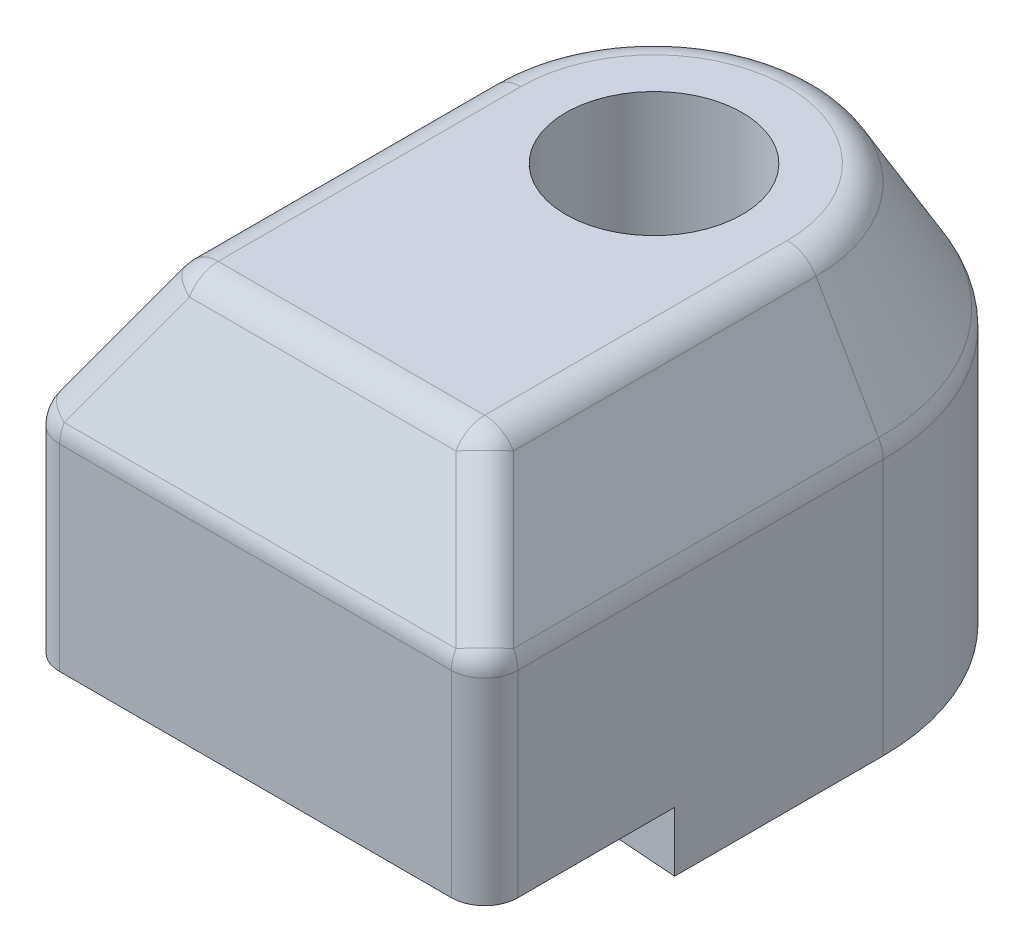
SolidWorks part; units mm, degrees
ref_plane "Front Plane" through (0, 0, 0) normal (0, 0, 1) x (1, 0, 0)
ref_plane "Top Plane" through (0, 0, 0) normal (0, 1, 0) x (1, 0, 0)
ref_plane "Right Plane" through (0, 0, 0) normal (1, 0, 0) x (0, 0, -1)
sketch "Sketch1" plane through (0, 0, 0) normal (0, 1, 0) x (1, 0, 0)
  line L0 (-8.763, 0) -> (-8.763, -15.24)
  line L1 (-8.763, -15.24) -> (8.763, -15.24)
  line L2 (8.763, -15.24) -> (8.763, 0)
  arc A0 (8.763, 0) -> (-8.763, 0) centre (0, 0) ccw
  arc A1 (8.89, 0) -> (-8.89, 0) centre (0, 0) ccw construction
  dimension "D1" = 0.127
  dimension "D2" = 15.24
extrude "Boss-Extrude1" add sketch "Sketch1" along normal blind 15.24
hole_wizard "H (0.266) Diameter Hole1" positions "Sketch2" profile "Sketch3" hole size "H" standard "ANSI Inch"
sketch "Sketch2" plane through (0, 15.24, 0) normal (0, 1, 0) x (1, 0, 0)
  point P0 (0, 0)
sketch "Sketch3" plane through (0, 15.24, 0) normal (1, 0, 0) x (0, 0, 1)
  line L0 (0, 0) -> (0, 15.24)
  line L1 (0, 15.24) -> (3.3782, 15.24)
  line L2 (3.3782, 15.24) -> (3.3782, 0)
  line L5 (3.3782, 0) -> (0, 0)
  line L11 (0, -6.35) -> (0, 107.95) construction
  dimension "Thru Hole Dia." = 6.7564
  dimension "Thru Hole Depth" = 15.24
sketch "Sketch5" plane through (0, 0, 0) normal (0, -1, 0) x (1, 0, 0)
  line L0 (-8.763, 15.24) -> (8.763, 15.24)
  line L1 (8.763, 15.24) -> (8.763, 7.9707)
  line L2 (8.763, 15.24) -> (8.763, 0) construction
  line L3 (-8.763, 15.24) -> (-8.763, 7.9707)
  line L4 (-8.763, 0) -> (-8.763, 15.24) construction
  arc A0 (-8.763, 7.9707) -> (8.763, 7.9707) centre (0, 117.2845) ccw
  arc A2 (-8.89, 7.9809) -> (8.89, 7.9809) centre (0, 117.2845) ccw construction
extrude "Cut-Extrude1" cut sketch "Sketch5" against normal blind 2.286
chamfer "Chamfer1" distance 5.08 angle 30 1 edges at (0, 15.24, 15.24)
chamfer "Chamfer2" distance 5.08 angle 30 3 edges at (8.763, 15.24, 6.1535) (0, 15.24, -8.763) (-8.763, 15.24, 6.1535)
fillet "Fillet1" radius 1.27 12 edges at (5.8301, 15.24, 6.1535) (8.763, 10.16, 7.62) (7.2965, 12.7, 13.7735) (0, 10.16, -8.763) (0, 15.24, -5.8301) (-8.763, 10.16, 7.62) (-5.8301, 15.24, 6.1535) (-7.2965, 12.7, 13.7735) (0, 15.24, 12.3071) (0, 10.16, 15.24) (8.763, 6.223, 15.24) (-8.763, 6.223, 15.24)
